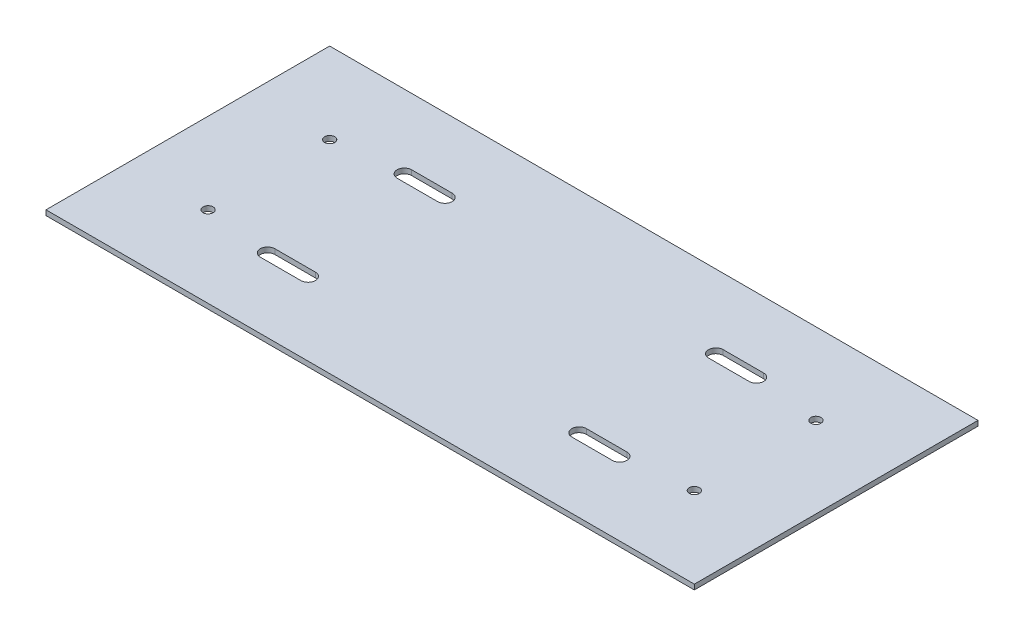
SolidWorks part; units mm, degrees
ref_plane "Front Plane" through (0, 0, 0) normal (0, 0, 1) x (1, 0, 0)
ref_plane "Top Plane" through (0, 0, 0) normal (0, 1, 0) x (1, 0, 0)
ref_plane "Right Plane" through (0, 0, 0) normal (1, 0, 0) x (0, 0, -1)
sketch "Sketch2" plane through (0, 0, 0) normal (0, 0, 1) x (1, 0, 0)
  line L0 (-203.2, 0) -> (203.2, 0)
  line L1 (203.2, 0) -> (203.2, 3.175)
  line L2 (203.2, 3.175) -> (-203.2, 3.175)
  line L3 (-203.2, 3.175) -> (-203.2, 0)
  point P3 (0, 0)
  dimension "D1" = 406.4
  dimension "D2" = 3.175
extrude "Boss-Extrude1" add sketch "Sketch2" along normal mid plane 355.6
sketch "Sketch4" plane through (0, 3.175, 0) normal (0, 1, 0) x (1, 0, 0)
  line L0 (-203.2, 177.8) -> (-203.2, 88.9)
  line L1 (-203.2, -177.8) -> (-203.2, 177.8) construction
  line L2 (-203.2, 88.9) -> (203.2, 88.9)
  line L3 (203.2, -177.8) -> (203.2, 177.8) construction
  line L4 (203.2, 88.9) -> (203.2, 177.8)
  line L5 (203.2, 177.8) -> (-203.2, 177.8) construction
  line L6 (203.2, 177.8) -> (-203.2, 177.8)
  line L7 (-279.5605, 0) -> (303.0136, 0) construction
  line L8 (203.2, -177.8) -> (-203.2, -177.8)
  line L9 (203.2, -88.9) -> (203.2, -177.8)
  line L10 (-203.2, -88.9) -> (203.2, -88.9)
  line L11 (-203.2, -177.8) -> (-203.2, -88.9)
  dimension "D1" = 88.9
extrude "Cut-Extrude2" cut sketch "Sketch4" against normal up to next
sketch "Sketch5" plane through (0, 3.175, 0) normal (0, 1, 0) x (1, 0, 0)
  line L0 (0, 124.2776) -> (0, -126.8476) construction
  line L1 (-203.2, -88.9) -> (-203.2, 88.9) construction
  line L2 (-203.2, 88.9) -> (203.2, 88.9) construction
  line L3 (203.2, -88.9) -> (-203.2, -88.9) construction
  circle A0 centre (-152.4, 38.1) radius 3.175
  circle A1 centre (-152.4, -38.1) radius 3.175
  circle A2 centre (152.4, -38.1) radius 3.175
  circle A3 centre (152.4, 38.1) radius 3.175
  dimension "D1" = 6.35
  dimension "D2" = 6.35
  dimension "D3" = 50.8
  dimension "D4" = 50.8
  dimension "D5" = 50.8
extrude "Cut-Extrude3" cut sketch "Sketch5" against normal through all
sketch "Sketch6" plane through (0, 3.175, 0) normal (0, 1, 0) x (1, 0, 0)
  line L0 (-110.3376, 47.4345) -> (-84.9376, 47.4345)
  line L1 (-110.3376, 38.2905) -> (-84.9376, 38.2905)
  line L2 (0, 139.6029) -> (0, -176.2302) construction
  line L3 (-309.3436, 0) -> (257.6639, 0) construction
  line L4 (110.3376, 38.2905) -> (84.9376, 38.2905)
  line L5 (110.3376, 47.4345) -> (84.9376, 47.4345)
  line L6 (110.3376, -47.4345) -> (84.9376, -47.4345)
  line L7 (110.3376, -38.2905) -> (84.9376, -38.2905)
  line L8 (-110.3376, -38.2905) -> (-84.9376, -38.2905)
  line L9 (-110.3376, -47.4345) -> (-84.9376, -47.4345)
  arc A0 (84.9376, 38.2905) -> (84.9376, 47.4345) centre (84.9376, 42.8625) cw
  arc A1 (-110.3376, 47.4345) -> (-110.3376, 38.2905) centre (-110.3376, 42.8625) ccw
  arc A2 (-84.9376, 38.2905) -> (-84.9376, 47.4345) centre (-84.9376, 42.8625) ccw
  arc A3 (110.3376, 47.4345) -> (110.3376, 38.2905) centre (110.3376, 42.8625) cw
  arc A4 (110.3376, -47.4345) -> (110.3376, -38.2905) centre (110.3376, -42.8625) ccw
  arc A5 (-84.9376, -38.2905) -> (-84.9376, -47.4345) centre (-84.9376, -42.8625) cw
  arc A6 (-110.3376, -47.4345) -> (-110.3376, -38.2905) centre (-110.3376, -42.8625) cw
  arc A7 (84.9376, -38.2905) -> (84.9376, -47.4345) centre (84.9376, -42.8625) ccw
  point P0 (-97.6376, 47.4345)
  dimension "D2" = 9.144
  dimension "D3" = 42.8625
  dimension "D4" = 4.572
  dimension "D5" = 97.6376
  dimension "D1" = 25.4
extrude "Cut-Extrude4" cut sketch "Sketch6" against normal through all
